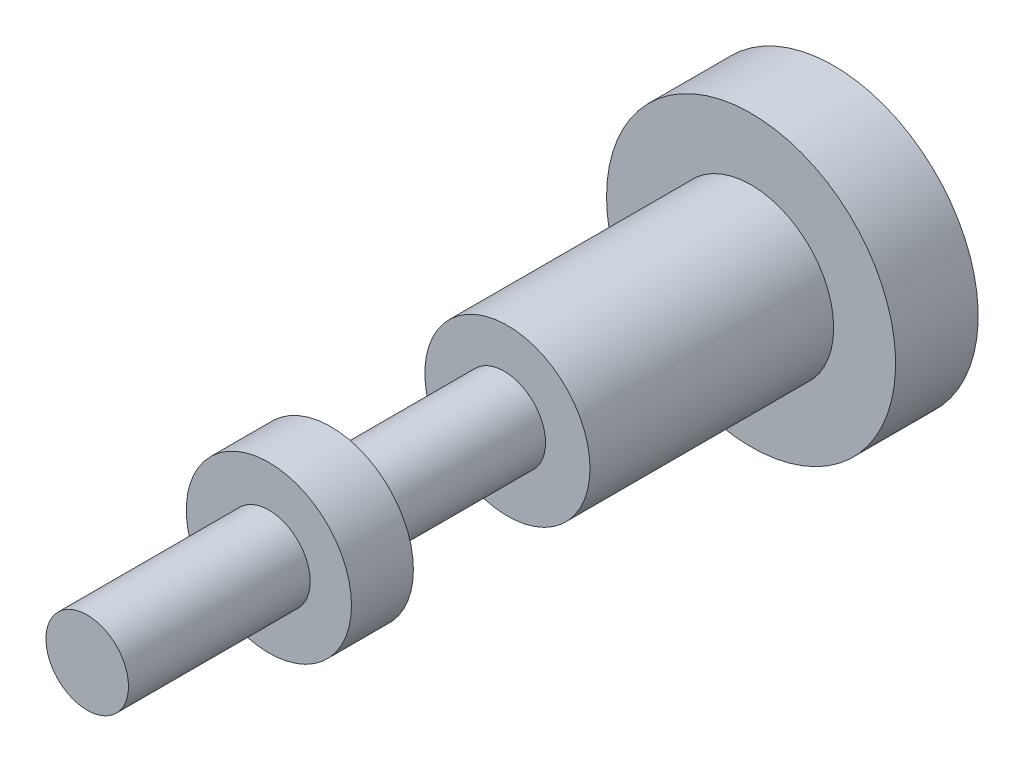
SolidWorks part; units mm, degrees
ref_plane "前基準面" through (0, 0, 0) normal (0, 0, 1) x (1, 0, 0)
ref_plane "上基準面" through (0, 0, 0) normal (0, 1, 0) x (1, 0, 0)
ref_plane "右基準面" through (0, 0, 0) normal (1, 0, 0) x (0, 0, -1)
sketch "草圖1" plane through (0, 0, 0) normal (0, 0, 1) x (1, 0, 0)
  circle A0 centre (-20.0282, 4.7978) radius 2
  dimension "D1" = 4
extrude "填料-伸長1" add sketch "草圖1" along normal blind 32
sketch "草圖2" plane through (0, 0, 0) normal (0, 0, -1) x (-1, 0, 0)
  circle A0 centre (20.0282, 4.7978) radius 7
  dimension "D1" = 14
extrude "填料-伸長2" add sketch "草圖2" along normal blind 4
sketch "草圖3" plane through (0, 0, 32) normal (0, 0, 1) x (1, 0, 0)
  circle A0 centre (-20.0282, 4.7978) radius 4
  circle A1 centre (-20.0282, 4.7978) radius 2
  dimension "D1" = 8
extrude "填料-伸長3" add sketch "草圖3" against normal blind 23.2
sketch "草圖4" plane through (0, 0, 32) normal (0, 0, 1) x (1, 0, 0)
  circle A0 centre (-20.0282, 4.7978) radius 4
  circle A1 centre (-20.1833, 4.7978) radius 2
  dimension "D1" = 4
extrude "除料-伸長1" cut sketch "草圖4" against normal blind 20.2
sketch "草圖6" plane through (0, 0, 32) normal (0, 0, 1) x (1, 0, 0)
  circle A0 centre (-20.1833, 4.7978) radius 2
  circle A1 centre (-20.1833, 4.6763) radius 4
  dimension "D1" = 8
extrude "填料-伸長4" add sketch "草圖6" against normal blind 11.8
sketch "草圖7" plane through (0, 0, 32) normal (0, 0, 1) x (1, 0, 0)
  circle A0 centre (-20.1833, 4.6763) radius 2
  circle A1 centre (-20.1833, 4.6763) radius 4
  dimension "D1" = 4
extrude "除料-伸長2" cut sketch "草圖7" against normal blind 8.8
sketch "草圖8" plane through (0, 0, 8.8) normal (0, 0, -1) x (-1, 0, 0)
  circle A0 centre (20.0282, 4.7978) radius 2
  circle A1 centre (20.0282, 4.7978) radius 4
extrude "填料-伸長5" add sketch "草圖8" along normal blind 8.8
